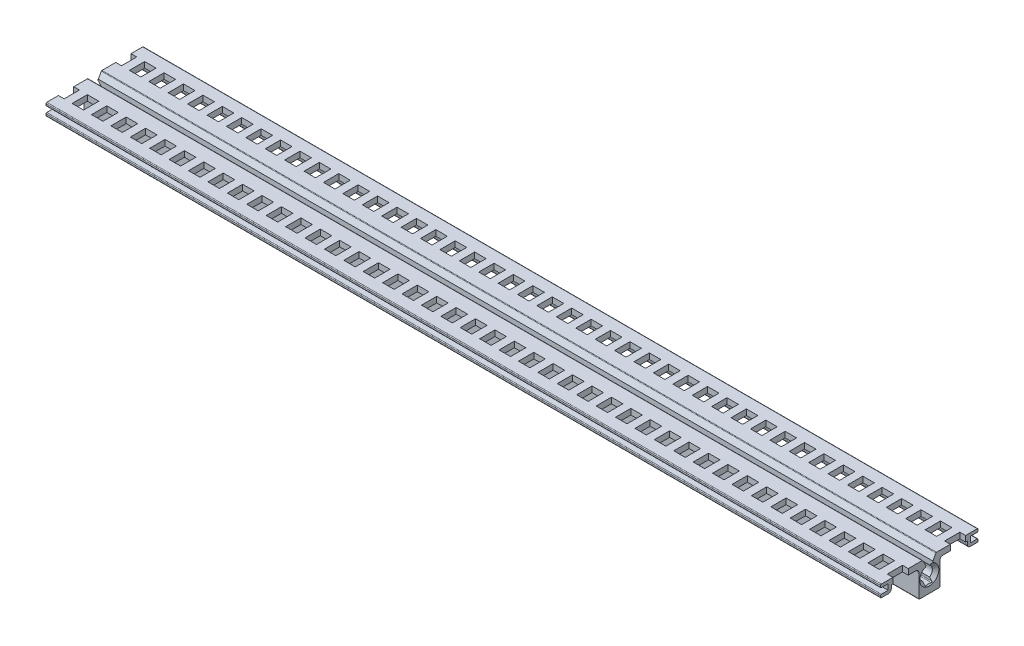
SolidWorks part; units mm, degrees
other "34561584"
ref_plane "前视基准面" through (0, 0, 0) normal (0, 0, 1) x (1, 0, 0)
ref_plane "上视基准面" through (0, 0, 0) normal (0, 1, 0) x (1, 0, 0)
ref_plane "右视基准面" through (0, 0, 0) normal (1, 0, 0) x (0, 0, -1)
imported_body "输入1"
sketch "草图1" plane through (0, 0, 10.25) normal (0, 0, 1) x (1, 0, 0)
  line L0 (-215.9, -2.3) -> (-215.9, -8.2) construction
  line L1 (215.9, 10.218) -> (2.54, 10.218)
  line L2 (215.9, 10.218) -> (215.9, -17.1182)
  line L3 (215.9, -17.1182) -> (2.54, -17.1182)
  line L4 (2.54, 10.218) -> (2.54, -17.1182)
  line L5 (215.9, -2.3) -> (215.9, -8.2) construction
  dimension "D1" = 218.44
extrude "切除-拉伸1" cut sketch "草图1" against normal mid plane 41
sketch "草图2" plane through (2.54, 0, 0) normal (1, 0, 0) x (0, 0, -1)
  circle A0 centre (-7.5, -4.2) radius 1.65
extrude "切除-拉伸2" cut sketch "草图2" against normal blind 15.02
chamfer "倒角1" distance 0.85 angle 45 1 edges at (2.54, -4.2, 9.15)
